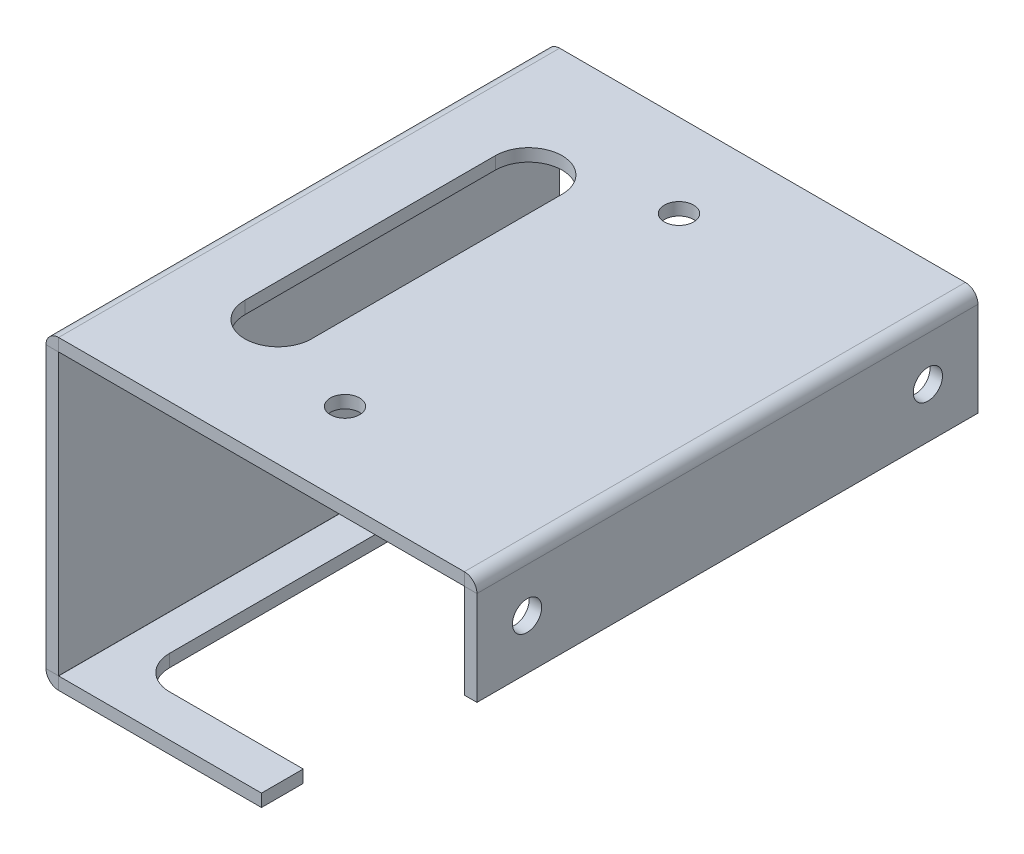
SolidWorks part; units mm, degrees
ref_plane "Front" through (0, 0, 0) normal (0, 0, 1) x (1, 0, 0)
ref_plane "Top" through (0, 0, 0) normal (0, 1, 0) x (1, 0, 0)
ref_plane "Right" through (0, 0, 0) normal (1, 0, 0) x (0, 0, -1)
sketch "Sketch1" plane through (0, 0, 0) normal (0, 1, 0) x (1, 0, 0)
  line L0 (76, 45) -> (76, 15)
  line L1 (0, 0) -> (122, 0)
  line L2 (0, 0) -> (0, 5)
  line L3 (0, 60) -> (122, 60)
  line L4 (122, 0) -> (122, 60)
  line L5 (68, 15) -> (68, 45)
  line L7 (20, 9) -> (20, 51)
  line L10 (0, 55) -> (16, 55)
  line L11 (0, 5) -> (16, 5)
  line L13 (0, 55) -> (0, 60)
  line L14 (0, 0) -> (0, 60) construction
  line L15 (0, 55) -> (122, 55) construction
  line L16 (20, 0) -> (20, 60) construction
  line L18 (0, 5) -> (122, 5) construction
  circle A0 centre (116, 54) radius 1.75
  circle A1 centre (116, 6) radius 1.75
  arc A2 (76, 45) -> (68, 45) centre (72, 45) ccw
  arc A3 (68, 15) -> (76, 15) centre (72, 15) ccw
  circle A4 centre (85, 50) radius 1.75
  circle A5 centre (85, 10) radius 1.75
  arc A6 (20, 51) -> (16, 55) centre (16, 51) ccw
  arc A7 (16, 5) -> (20, 9) centre (16, 9) ccw
sheet metal parameters "Sheet-Metal1" thickness 1.5 parameters "D1"=0.01
base flange "Base-Flange1" sketch "Sketch1" thickness 1.5 reverse thickness direction yes parameters "D1"=0.01
sketch "Sketch3" plane through (0, 1.5, 0) normal (0, 1, 0) x (-1, 0, 0)
  line L1 (-110, -60) -> (-110, 0)
  line L3 (-60, -60) -> (-60, 0)
  line L4 (-25, -60) -> (-25, 0)
sketched bend "Sketched Bend1" parameters "D1"=0
bend "SketchBend1" bend radius 0.01 bend angle 90 parameters "D5"=1
bend "SketchBend2" bend radius 0 bend angle 90 parameters "D5"=2
bend "SketchBend3" bend radius 0 bend angle 90 parameters "D5"=3
flat pattern "Flat-Pattern1"
sketch "Bend-Lines1" plane through (0, 1.5, 0) normal (0, 1, 0) x (-1, 0, 0)
  line L0 (-25, 0) -> (-25, -60) construction
  line L1 (-60, 0) -> (-60, -60) construction
  line L2 (-110, 0) -> (-110, -60) construction
bend of the flat pattern "Flatten-<SketchBend1>1"
bend of the flat pattern "Flatten-<SketchBend2>1"
bend of the flat pattern "Flatten-<SketchBend3>1"
